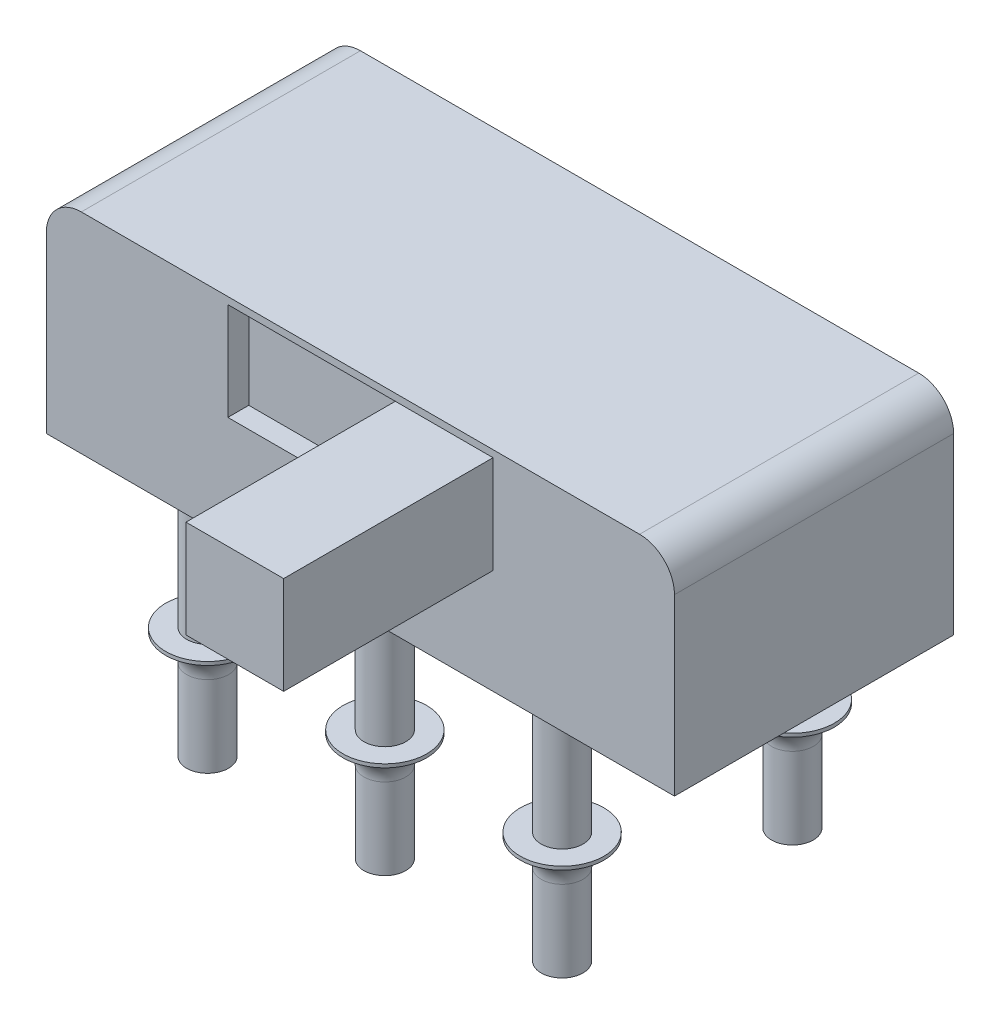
SolidWorks part; units mm, degrees
ref_plane "Plan de face" through (0, 0, 0) normal (0, 0, 1) x (1, 0, 0)
ref_plane "Plan de dessus" through (0, 0, 0) normal (0, 1, 0) x (1, 0, 0)
ref_plane "Plan de droite" through (0, 0, 0) normal (1, 0, 0) x (0, 0, -1)
sketch "Esquisse1" plane through (0, 0, 0) normal (0, 1, 0) x (1, 0, 0)
  line L1 (-4.5, -2) -> (4.5, -2)
  line L2 (-4.5, -2) -> (-4.5, 2)
  line L3 (-4.5, 2) -> (4.5, 2)
  line L4 (4.5, -2) -> (4.5, 2)
  line L5 (-4.5, -2) -> (4.5, 2) construction
  line L6 (-4.5, 2) -> (4.5, -2) construction
  point P0 (0, 0)
  dimension "D1" = 9
  dimension "D2" = 4
extrude "Boss.-Extru.1" add sketch "Esquisse1" along normal blind 3
sketch "Esquisse2" plane through (0, 0, 2) normal (0, 0, 1) x (1, 0, 0)
  line L0 (4.5, 3) -> (4.5, 0) construction
  line L1 (1.9, 2.9) -> (0.5, 2.9)
  line L2 (1.9, 2.9) -> (1.9, 1.5)
  line L3 (1.9, 1.5) -> (0.5, 1.5)
  line L4 (0.5, 2.9) -> (0.5, 1.5)
  line L5 (-4.5, 3) -> (4.5, 3) construction
  dimension "D1" = 2.6
  dimension "D2" = 1.4
  dimension "D3" = 0.1
extrude "Boss.-Extru.2" add sketch "Esquisse2" along normal blind 3
sketch "Esquisse3" plane through (0, 0, 2) normal (0, 0, 1) x (1, 0, 0)
  line L0 (-4.5, 3) -> (-4.5, 0) construction
  line L1 (0.5, 2.9) -> (-1.9, 2.9)
  line L2 (0.5, 2.9) -> (0.5, 1.5)
  line L3 (0.5, 1.5) -> (-1.9, 1.5)
  line L4 (-1.9, 2.9) -> (-1.9, 1.5)
  line L5 (0.5, 1.5) -> (1.9, 1.5) construction
  dimension "D1" = 2.6
extrude "Enlèv. mat.-Extru.1" cut sketch "Esquisse3" against normal blind 0.3
sketch "Esquisse4" plane through (0, 0, 0) normal (0, -1, 0) x (1, 0, 0)
  circle A0 centre (-2.54, -1.65) radius 0.3
  dimension "D1" = 0.6
  dimension "D3" = 1.65
  dimension "D2" = 2.54
extrude "Boss.-Extru.3" add sketch "Esquisse4" along normal blind 3.2
ref_plane "Plan1" through (0, -1.6, 0) normal (0, -1, 0) x (-1, 0, 0)
sketch "Esquisse5" plane through (0, -1.6, 0) normal (0, -1, 0) x (-1, 0, 0)
  circle A0 centre (2.54, 1.65) radius 0.6
extrude "Boss.-Extru.4" add sketch "Esquisse5" along normal blind 0.05
fillet "Congé1" radius 0.4 1 edges at (-2.54, -1.65, -1.95)
pattern_linear "Répétition linéaire2" count 3 spacing 2.54 along (1, 0, 0) count 2 spacing 3.3 along (0, 0, 1) of "Boss.-Extru.3", "Congé1", "Boss.-Extru.4"
fillet "Congé2" radius 0.5 2 edges at (-4.5, 3, 0) (4.5, 3, 0)
